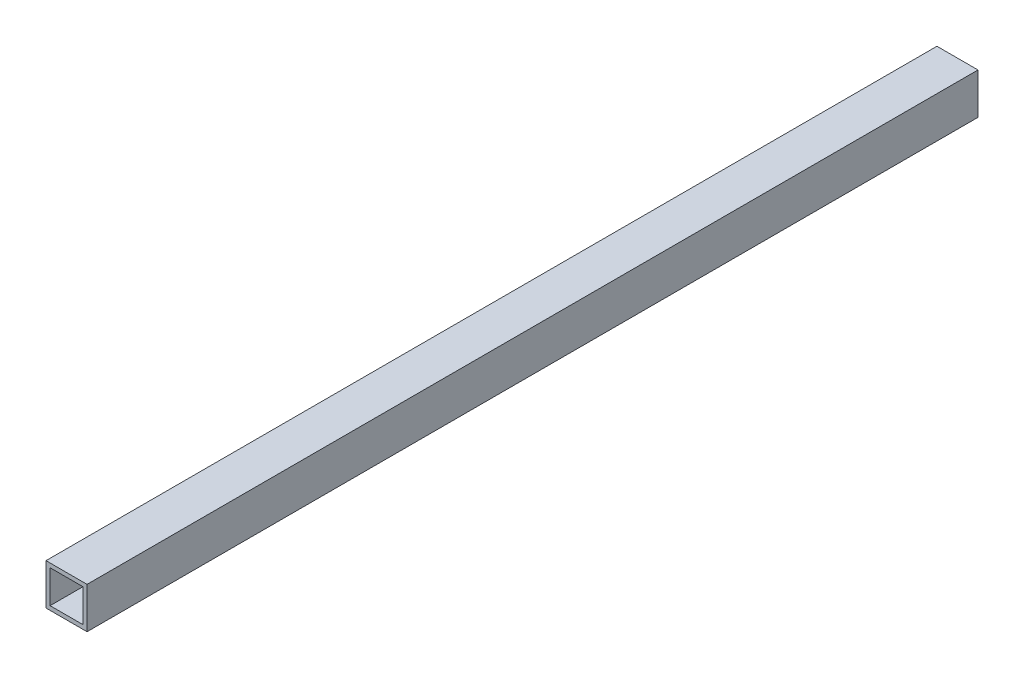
SolidWorks part; units mm, degrees
ref_plane "Plan de face" through (0, 0, 0) normal (0, 0, 1) x (1, 0, 0)
ref_plane "Plan de dessus" through (0, 0, 0) normal (0, 1, 0) x (1, 0, 0)
ref_plane "Plan de droite" through (0, 0, 0) normal (1, 0, 0) x (0, 0, -1)
sketch "Esquisse1" plane through (0, 0, 0) normal (0, 0, 1) x (1, 0, 0)
  line L0 (-4.9194, 6.2171) -> (5.0806, -3.7829) construction
  line L1 (-4.9194, 6.2171) -> (5.0806, 6.2171)
  line L2 (-4.9194, 6.2171) -> (-4.9194, -3.7829)
  line L3 (-4.9194, -3.7829) -> (5.0806, -3.7829)
  line L4 (5.0806, 6.2171) -> (5.0806, -3.7829)
  line L5 (5.0806, 6.2171) -> (-4.9194, -3.7829) construction
  line L7 (4.0806, -2.7829) -> (-3.9194, -2.7829)
  line L8 (4.0806, -2.7829) -> (4.0806, 5.2171)
  line L9 (4.0806, 5.2171) -> (-3.9194, 5.2171)
  line L10 (-3.9194, -2.7829) -> (-3.9194, 5.2171)
  line L11 (4.0806, -2.7829) -> (-3.9194, 5.2171) construction
  line L12 (4.0806, 5.2171) -> (-3.9194, -2.7829) construction
  point P4 (0.0806, 1.2171)
  dimension "D1" = 10
  dimension "D2" = 1
extrude "Boss.-Extru.2" add sketch "Esquisse1" along normal blind 217
